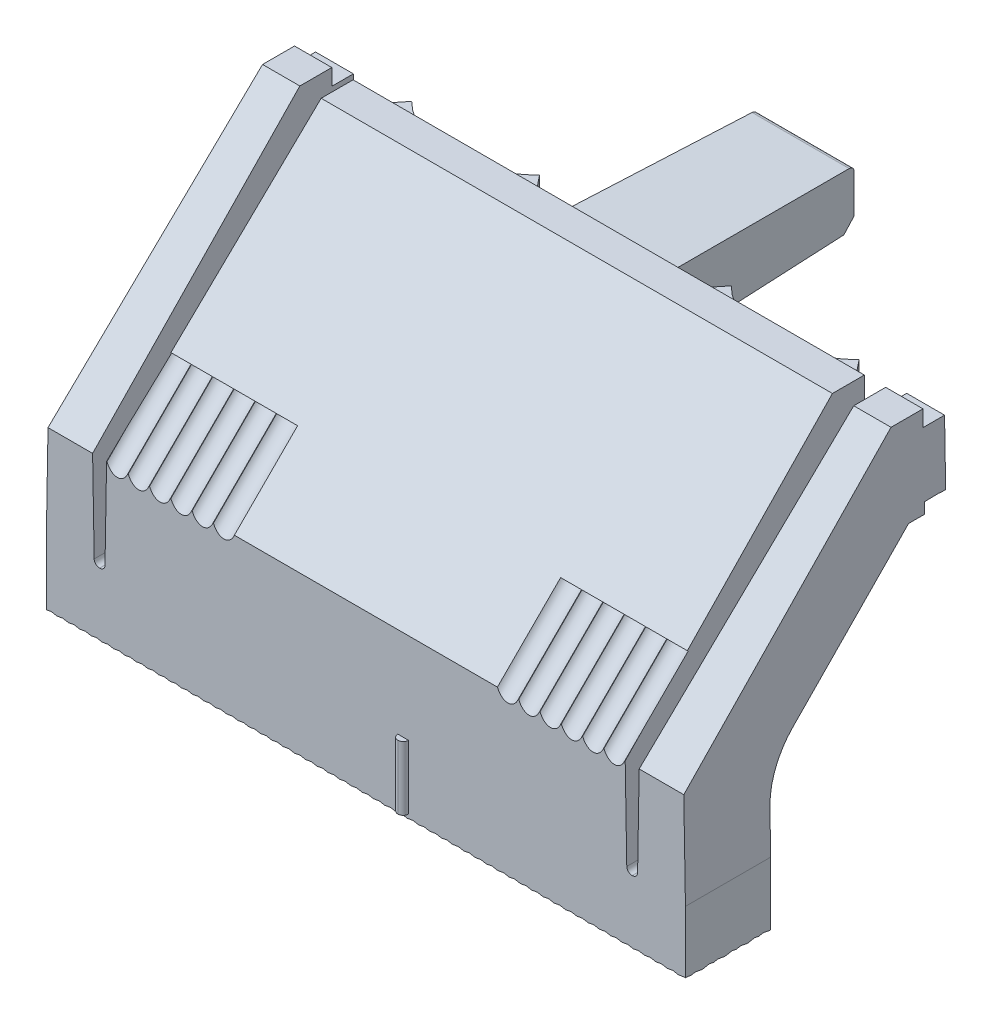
SolidWorks part; units mm, degrees
ref_plane "Plan de face" through (0, 0, 0) normal (0, 0, 1) x (1, 0, 0)
ref_plane "Plan de dessus" through (0, 0, 0) normal (0, 1, 0) x (1, 0, 0)
ref_plane "Plan de droite" through (0, 0, 0) normal (1, 0, 0) x (0, 0, -1)
sketch "Esquisse1" plane through (0, 0, 0) normal (1, 0, 0) x (0, 0, -1)
  line L0 (-4, -15) -> (4, -15)
  line L1 (-4, -15) -> (-4, 0)
  line L2 (-4, 0) -> (15.799, 19.799)
  line L3 (15.799, 19.799) -> (18.799, 19.799)
  line L4 (18.799, 19.799) -> (18.799, 4.508) construction
  line L5 (18.799, 19.799) -> (18.799, 18.299)
  line L6 (4, -15) -> (4, 11.299) construction
  line L7 (17.299, 11.299) -> (2.5901, -3.4099) construction
  line L8 (18.799, 11.299) -> (17.299, 11.299)
  line L9 (17.299, 11.299) -> (4, -1.8505)
  line L10 (4, -1.8505) -> (4, -15)
  line L11 (17.299, 15.299) -> (39.1771, 15.299) construction
  line L12 (18.799, 18.299) -> (37.299, 18.299)
  line L13 (18.799, 12.299) -> (37.299, 12.299)
  line L14 (37.299, 18.299) -> (37.299, 12.299)
  line L15 (18.799, 12.299) -> (18.799, 11.299)
  dimension "D1" = 8
  dimension "D2" = 15
  dimension "D3" = 4
  dimension "D4" = 15
  dimension "D5" = 28
  dimension "D6" = 45
  dimension "D7" = 3
  dimension "D8" = 8.5
  dimension "D9" = 18.7022
  dimension "D10" = 4.5
  dimension "D11" = 1.5
  dimension "D12" = 18.5
  dimension "D13" = 1.5
  dimension "D14" = 3
  dimension "D15" = 1
extrude "Extrusion1" add sketch "Esquisse1" along normal mid plane 60
sketch "Esquisse2" plane through (0, 18.299, 0) normal (0, 1, 0) x (-1, 0, 0)
  line L0 (0, 0) -> (0, -49.2838) construction
  line L1 (-5, -37.299) -> (5, -37.299)
  line L2 (-30, -37.299) -> (30, -37.299) construction
  line L3 (5, -37.299) -> (5, -18.799)
  line L4 (-30, -18.799) -> (30, -18.799) construction
  line L5 (5, -18.799) -> (7, -18.799)
  line L6 (7, -18.799) -> (9, -21.299)
  line L7 (9, -21.299) -> (21, -21.299)
  line L8 (21, -21.299) -> (23, -18.799)
  line L9 (23, -18.799) -> (25, -18.799)
  line L10 (25, -18.799) -> (25, -20.799)
  line L11 (25, -20.799) -> (32.5439, -20.799)
  line L13 (32.5439, -20.799) -> (32.5439, -41.148)
  line L14 (32.5439, -41.148) -> (-32.5439, -41.148)
  line L15 (-5, -18.799) -> (-7, -18.799)
  line L16 (-7, -18.799) -> (-9, -21.299)
  line L17 (-9, -21.299) -> (-21, -21.299)
  line L18 (-21, -21.299) -> (-23, -18.799)
  line L19 (-23, -18.799) -> (-25, -18.799)
  line L20 (-25, -18.799) -> (-25, -20.799)
  line L21 (-25, -20.799) -> (-32.5439, -20.799)
  line L22 (-32.5439, -20.799) -> (-32.5439, -41.148)
  line L23 (-5, -37.299) -> (-5, -18.799)
  point P3 (0, -41.148)
  point P29 (0, -37.299)
  dimension "D1" = 5
  dimension "D2" = 2
  dimension "D3" = 4
  dimension "D4" = 2.5
  dimension "D5" = 12
  dimension "D6" = 14
  dimension "D7" = 2
  dimension "D8" = 2
  dimension "D9" = 20.349
  dimension "D10" = 32.5439
extrude "Enlèv. mat.-Extru.1" cut sketch "Esquisse2" against normal through all
sketch "Esquisse3" plane through (0, 18.299, 0) normal (0, 1, 0) x (-1, 0, 0)
  line L0 (0, 0) -> (0, -43.032) construction
  line L1 (9, -21.299) -> (9, -24.2102)
  line L2 (9, -24.2102) -> (21, -24.2102)
  line L3 (21, -24.2102) -> (21, -21.299)
  line L4 (-21, -24.2102) -> (-21, -21.299)
  line L5 (-9, -24.2102) -> (-21, -24.2102)
  line L6 (-9, -21.299) -> (-9, -24.2102)
  arc A0 (9, -21.299) -> (21, -21.299) centre (15, -27.3198) cw
  arc A1 (-9, -21.299) -> (-21, -21.299) centre (-15, -27.3198) ccw
  dimension "D1" = 8.5
  dimension "D2" = 2.9113
extrude "Enlèv. mat.-Extru.2" cut sketch "Esquisse3" against normal through all
draft "Dépouille1" type of draft neutral plane draft angle 1.4 faces to draft 2 parameters "D1"=1.4
draft "Dépouille2" type of draft neutral plane draft angle 1.4 faces to draft 2 parameters "D1"=1.4
chamfer "Chanfrein1" distance 1 angle 45 1 edges at (0, 12.7511, -37.299)
sketch "Esquisse4" plane through (0, 11.8325, 0.2892) normal (0, -0.9997, -0.0244) x (1, 0, 0)
  line L0 (0, 0) -> (0, -42.5855) construction
  line L1 (4.5479, -37.6244) -> (-4.5479, -37.6244) construction
  line L2 (2.5, -31.6244) -> (-2.5, -31.6244)
  line L3 (2.5, -31.6244) -> (2.5, -34.6244)
  line L4 (2.5, -34.6244) -> (-2.5, -34.6244)
  line L5 (-2.5, -31.6244) -> (-2.5, -34.6244)
  dimension "D1" = 3
  dimension "D2" = 3
  dimension "D3" = 5
  dimension "D4" = 5
extrude "Enlèv. mat.-Extru.3" cut sketch "Esquisse4" against normal blind 3
fillet "Congé1" radius 0.5 1 edges at (0, 17.8469, -37.299)
sketch "Esquisse5" plane through (0, 0, 4) normal (0, 0, 1) x (1, 0, 0)
  line L0 (0, 23.5106) -> (0, -19.7744) construction
  line L1 (-29.5, 19.799) -> (-26, 19.799)
  line L2 (30, 19.799) -> (-30, 19.799) construction
  line L3 (-30, -9) -> (-29.5, 19.799)
  line L6 (-30, 0) -> (-30, -15) construction
  line L7 (30, -15) -> (-30, -15) construction
  line L8 (-30, 19.799) -> (-30, 0) construction
  line L9 (-26, 19.799) -> (-25.5, -9)
  line L10 (-24.5, -9) -> (-24, 19.799)
  line L11 (-25.5, -9) -> (-24.5, -9)
  line L12 (-30, -9) -> (-30, 28.654)
  line L13 (-30, 28.654) -> (-24, 28.654)
  line L14 (-24, 28.654) -> (-24, 19.799)
  line L15 (25.5, -9) -> (24.5, -9)
  line L16 (24, 28.654) -> (24, 19.799)
  line L17 (24.5, -9) -> (24, 19.799)
  line L18 (26, 19.799) -> (25.5, -9)
  line L19 (29.5, 19.799) -> (26, 19.799)
  line L20 (30, 28.654) -> (24, 28.654)
  line L21 (30, -9) -> (29.5, 19.799)
  line L22 (30, -9) -> (30, 28.654)
  dimension "D1" = 6
  dimension "D2" = 0.5
  dimension "D3" = 6
  dimension "D4" = 1
  dimension "D5" = 6
  dimension "D6" = 3.5
  dimension "D7" = 2
  dimension "D8" = 4.5
  dimension "D9" = 8.855
extrude "Enlèv. mat.-Extru.4" cut sketch "Esquisse5" against normal through all
fillet "Congé2" radius 0.5 4 edges at (25.5, -9, 0) (24.5, -9, 0) (-24.5, -9, 0) (-25.5, -9, 0)
sketch "Esquisse8" plane through (0, -2.9356, -2.9026) normal (0, -0.7111, -0.7031) x (1, 0, 0)
  line L0 (0, 15.8392) -> (0, -27.2885) construction
  line L1 (24, -27.2885) -> (-24, -27.2885) construction
  line L2 (24.3759, -1.5433) -> (-24.3759, -1.5433) construction
  line L3 (2, -23.0469) -> (-2, -23.0469)
  line L4 (2, -23.0469) -> (2, 9.9625)
  line L5 (2, 9.9625) -> (-2, 9.9625)
  line L6 (-2, -23.0469) -> (-2, 9.9625)
  dimension "D1" = 4
  dimension "D2" = 33.0094
  dimension "D3" = 2
  dimension "D4" = 11.5058
extrude "Extrusion3" add sketch "Esquisse8" along normal blind 7
sketch "Esquisse9" plane through (-2, 0, 0) normal (-1, 0, 0) x (0, 0, 1)
  line L0 (-18.799, 12.299) -> (-18.799, 2.9381)
  line L1 (-4, -11.6945) -> (-24.2127, 8.291) construction
  line L2 (-18.799, 12.299) -> (-20.2156, 12.3336)
  line L3 (-20.2156, 12.3336) -> (-26.1871, 6.2942)
  line L4 (-14.2087, -9) -> (0, -9) construction
  line L5 (4, -15) -> (-4, -15) construction
  line L6 (-4, -9) -> (-6.7252, -9)
  line L7 (-6.7252, -9) -> (-18.799, 2.9381)
  line L8 (-4, -9) -> (-4, -12.4993)
  line L9 (-4, -15) -> (-4, -9) construction
  line L10 (-4, -12.4993) -> (-6.7252, -12.8306)
  line L11 (-6.7252, -12.8306) -> (-26.1871, 6.2942)
  dimension "D1" = 6
  dimension "D2" = 2.7252
  dimension "D3" = 16.9793
  dimension "D4" = 2.7452
  dimension "D5" = 27.286
  dimension "D6" = 8.4932
extrude "Enlèv. mat.-Extru.5" cut sketch "Esquisse9" against normal through all
ref_plane "Plan2" through (0, -9.5, 9.5) normal (0, -0.7071, 0.7071) x (1, 0, 0)
sketch "Esquisse12" plane through (0, -9.5, 9.5) normal (0, -0.7071, 0.7071) x (1, 0, 0)
  line L0 (-24.3295, 2.8608) -> (-24.3295, 7.2103)
  line L1 (-12.3295, 2.8608) -> (-12.3295, 7.2103)
  line L2 (-12.3295, 7.2103) -> (-24.3295, 7.2103)
  line L3 (0, -1.5673) -> (0, 17.1731) construction
  line L4 (12.3295, 2.8608) -> (12.3295, 7.2103)
  line L5 (12.3295, 7.2103) -> (24.3295, 7.2103)
  line L6 (24.3295, 2.8608) -> (24.3295, 7.2103)
  arc A0 (-24.3295, 2.8608) -> (-22.3295, 2.8608) centre (-23.3295, 3.4009) ccw
  arc A1 (-22.3295, 2.8608) -> (-20.3295, 2.8608) centre (-21.3295, 3.4009) ccw
  arc A2 (-20.3295, 2.8608) -> (-18.3295, 2.8608) centre (-19.3295, 3.4009) ccw
  arc A3 (-18.3295, 2.8608) -> (-16.3295, 2.8608) centre (-17.3295, 3.4009) ccw
  arc A4 (-16.3295, 2.8608) -> (-14.3295, 2.8608) centre (-15.3295, 3.4009) ccw
  arc A5 (-14.3295, 2.8608) -> (-12.3295, 2.8608) centre (-13.3295, 3.4009) ccw
  arc A6 (14.3295, 2.8608) -> (12.3295, 2.8608) centre (13.3295, 3.4009) cw
  arc A7 (16.3295, 2.8608) -> (14.3295, 2.8608) centre (15.3295, 3.4009) cw
  arc A8 (18.3295, 2.8608) -> (16.3295, 2.8608) centre (17.3295, 3.4009) cw
  arc A9 (20.3295, 2.8608) -> (18.3295, 2.8608) centre (19.3295, 3.4009) cw
  arc A10 (22.3295, 2.8608) -> (20.3295, 2.8608) centre (21.3295, 3.4009) cw
  arc A11 (24.3295, 2.8608) -> (22.3295, 2.8608) centre (23.3295, 3.4009) cw
  dimension "D2" = 1.1366
  dimension "D5" = 5.5143
  dimension "D1" = 2
  dimension "D3" = 4.3496
  dimension "D4" = 12
extrude "Enlèv. mat.-Extru.6" cut sketch "Esquisse12" against normal blind 19
sketch "Esquisse13" plane through (2, 0, 0) normal (1, 0, 0) x (0, 0, -1)
  line L0 (-4, -9.7606) -> (-4.1817, -9.9402)
  line L1 (-4.1817, -9.9402) -> (-4, -10.1239)
  line L2 (-4, -10.1239) -> (-4, -9.7606)
extrude "Enlèv. mat.-Extru.7" cut sketch "Esquisse13" against normal through all
sketch "Esquisse14" plane through (0, 0, 4) normal (0, 0, 1) x (1, 0, 0)
  line L0 (30, -9) -> (30, -15) construction
  line L1 (3, -8.5) -> (4, -8.5)
  line L2 (3, -8.5) -> (3, -14.5)
  line L3 (3, -14.5) -> (4, -14.5)
  line L4 (4, -8.5) -> (4, -14.5)
  line L5 (30, -15) -> (-30, -15) construction
  point P4 (30, -12)
  dimension "D1" = 1
  dimension "D2" = 26
  dimension "D3" = 0.5
  dimension "D4" = 6
extrude "Extrusion4" add sketch "Esquisse14" along normal blind 0.5
fillet "Congé3" radius 0.5 2 edges at (3, -11.5, 4.5) (4, -11.5, 4.5)
sketch "Esquisse15" plane through (0, 0, -4) normal (0, 0, -1) x (-1, 0, 0)
  line L0 (0, 0) -> (0, -27.609) construction
  line L1 (-30, -15) -> (30, -15) construction
  line L2 (-29, -9) -> (-28, -9)
  line L3 (-29, -9) -> (-29, 4.4636)
  line L4 (-29, 4.4636) -> (-28, 4.4636)
  line L5 (-28, -9) -> (-28, 4.4636)
  line L6 (-30, -15) -> (-30, -9) construction
  line L7 (29, 4.4636) -> (28, 4.4636)
  line L8 (28, -9) -> (28, 4.4636)
  line L9 (29, -9) -> (29, 4.4636)
  line L10 (29, -9) -> (28, -9)
  dimension "D1" = 6
  dimension "D2" = 1
  dimension "D3" = 1
extrude "Extrusion5" add sketch "Esquisse15" along normal blind 1
fillet "Congé4" radius 0.5 4 edges at (-29, -4.9309, -5) (-28, -4.9309, -5) (28, -4.9309, -5) (29, -4.9309, -5)
fillet "Congé5" radius 7.5 1 edges at (-13.1879, -1.8505, -4)
fillet "Congé7" radius 7.5 1 edges at (-26.8121, -1.8505, -4)
fillet "Congé8" radius 7.5 2 edges at (26.8121, -1.8505, -4) (13.1879, -1.8505, -4)
ref_plane "Plan4" through (-17, 0, 17) normal (0.7071, 0, -0.7071) x (-0.7071, 0, -0.7071)
sketch "Esquisse16" plane through (-17, 0, 17) normal (0.7071, 0, -0.7071) x (-0.7071, 0, -0.7071)
  line L0 (20.7761, -15) -> (25.8072, -15) construction
  line L1 (-18.3848, -15) -> (24.0416, -15) construction
  line L2 (24.0416, -14.8) -> (23.2916, -15)
  line L3 (24.0416, -15) -> (24.0416, -9) construction
  line L4 (23.2916, -15) -> (22.5416, -14.8)
  line L5 (21.7916, -15) -> (21.0416, -14.8)
  line L6 (22.5416, -14.8) -> (21.7916, -15)
  line L7 (20.2916, -15) -> (19.5416, -14.8)
  line L8 (21.0416, -14.8) -> (20.2916, -15)
  line L9 (18.7916, -15) -> (18.0416, -14.8)
  line L10 (19.5416, -14.8) -> (18.7916, -15)
  line L11 (17.2916, -15) -> (16.5416, -14.8)
  line L12 (18.0416, -14.8) -> (17.2916, -15)
  line L13 (15.7916, -15) -> (15.0416, -14.8)
  line L14 (16.5416, -14.8) -> (15.7916, -15)
  line L15 (14.2916, -15) -> (13.5416, -14.8)
  line L16 (15.0416, -14.8) -> (14.2916, -15)
  line L17 (12.7916, -15) -> (12.0416, -14.8)
  line L18 (13.5416, -14.8) -> (12.7916, -15)
  line L19 (11.2916, -15) -> (10.5416, -14.8)
  line L20 (12.0416, -14.8) -> (11.2916, -15)
  line L21 (9.7916, -15) -> (9.0416, -14.8)
  line L22 (10.5416, -14.8) -> (9.7916, -15)
  line L23 (8.2916, -15) -> (7.5416, -14.8)
  line L24 (9.0416, -14.8) -> (8.2916, -15)
  line L25 (6.7916, -15) -> (6.0416, -14.8)
  line L26 (7.5416, -14.8) -> (6.7916, -15)
  line L27 (5.2916, -15) -> (4.5416, -14.8)
  line L28 (6.0416, -14.8) -> (5.2916, -15)
  line L29 (3.7916, -15) -> (3.0416, -14.8)
  line L30 (4.5416, -14.8) -> (3.7916, -15)
  line L31 (2.2916, -15) -> (1.5416, -14.8)
  line L32 (3.0416, -14.8) -> (2.2916, -15)
  line L33 (0.7916, -15) -> (0.0416, -14.8)
  line L34 (1.5416, -14.8) -> (0.7916, -15)
  line L35 (-0.7084, -15) -> (-1.4584, -14.8)
  line L36 (0.0416, -14.8) -> (-0.7084, -15)
  line L37 (-2.2084, -15) -> (-2.9584, -14.8)
  line L38 (-1.4584, -14.8) -> (-2.2084, -15)
  line L39 (-3.7084, -15) -> (-4.4584, -14.8)
  line L40 (-2.9584, -14.8) -> (-3.7084, -15)
  line L41 (-5.2084, -15) -> (-5.9584, -14.8)
  line L42 (-4.4584, -14.8) -> (-5.2084, -15)
  line L43 (-6.7084, -15) -> (-7.4584, -14.8)
  line L44 (-5.9584, -14.8) -> (-6.7084, -15)
  line L45 (-8.2084, -15) -> (-8.9584, -14.8)
  line L46 (-7.4584, -14.8) -> (-8.2084, -15)
  line L47 (-9.7084, -15) -> (-10.4584, -14.8)
  line L48 (-8.9584, -14.8) -> (-9.7084, -15)
  line L49 (-11.2084, -15) -> (-11.9584, -14.8)
  line L50 (-10.4584, -14.8) -> (-11.2084, -15)
  line L51 (-12.7084, -15) -> (-13.4584, -14.8)
  line L52 (-11.9584, -14.8) -> (-12.7084, -15)
  line L53 (-14.2084, -15) -> (-14.9584, -14.8)
  line L54 (-13.4584, -14.8) -> (-14.2084, -15)
  line L55 (-15.7084, -15) -> (-16.4584, -14.8)
  line L56 (-14.9584, -14.8) -> (-15.7084, -15)
  line L57 (-17.2084, -15) -> (-17.9584, -14.8)
  line L58 (-16.4584, -14.8) -> (-17.2084, -15)
  line L59 (-18.7084, -15) -> (-19.4584, -14.8)
  line L60 (-17.9584, -14.8) -> (-18.7084, -15)
  line L61 (-20.2084, -15) -> (-20.9584, -14.8)
  line L62 (-19.4584, -14.8) -> (-20.2084, -15)
  line L63 (-21.7084, -15) -> (-22.4584, -14.8)
  line L64 (-20.9584, -14.8) -> (-21.7084, -15)
  line L65 (-23.2084, -15) -> (-23.9584, -14.8)
  line L66 (-22.4584, -14.8) -> (-23.2084, -15)
  line L67 (-23.9584, -14.8) -> (-24.0416, -14.826)
  line L68 (-24.0416, -9) -> (-24.0416, -15) construction
  line L69 (-24.0416, -14.826) -> (-24.0416, -15.182)
  line L70 (24.0416, -14.8) -> (24.0416, -15.8513)
  line L71 (24.0416, -15.8513) -> (-24.0416, -15.182)
  line L87 (-35.2084, -15) -> (-35.9584, -14.8)
  line L88 (-34.4584, -14.8) -> (-35.2084, -15)
  line L89 (-33.7084, -15) -> (-34.4584, -14.8)
  line L90 (-32.9584, -14.8) -> (-33.7084, -15)
  line L91 (-32.2084, -15) -> (-32.9584, -14.8)
  line L92 (-31.4584, -14.8) -> (-32.2084, -15)
  line L93 (-30.7084, -15) -> (-31.4584, -14.8)
  line L94 (-29.9584, -14.8) -> (-30.7084, -15)
  line L95 (-29.2084, -15) -> (-29.9584, -14.8)
  line L96 (-28.4584, -14.8) -> (-29.2084, -15)
  line L97 (-27.7084, -15) -> (-28.4584, -14.8)
  line L98 (-26.9584, -14.8) -> (-27.7084, -15)
  line L99 (-26.2084, -15) -> (-26.9584, -14.8)
  line L100 (-25.4584, -14.8) -> (-26.2084, -15)
  line L101 (-24.7084, -15) -> (-25.4584, -14.8)
  line L102 (-23.9584, -14.8) -> (-24.7084, -15)
  dimension "D1" = 0.4
  dimension "D2" = 0.75
  dimension "D3" = 0.75
  dimension "D4" = 0.4
extrude "Enlèv. mat.-Extru.11" cut sketch "Esquisse16" along normal through all
ref_plane "Plan7" through (17, 0, 17) normal (0.7071, 0, 0.7071) x (0.7071, 0, -0.7071)
sketch "Esquisse17" plane through (17, 0, 17) normal (0.7071, 0, 0.7071) x (0.7071, 0, -0.7071)
  line L0 (16.8652, -15) -> (26.9234, -15) construction
  line L1 (24.2967, -15) -> (25.0467, -14.8)
  line L2 (25.0467, -14.8) -> (25.7967, -15)
  line L3 (22.7967, -15) -> (23.5467, -14.8)
  line L4 (23.5467, -14.8) -> (24.2967, -15)
  line L5 (21.2967, -15) -> (22.0467, -14.8)
  line L6 (22.0467, -14.8) -> (22.7967, -15)
  line L7 (19.7967, -15) -> (20.5467, -14.8)
  line L8 (20.5467, -14.8) -> (21.2967, -15)
  line L9 (18.2967, -15) -> (19.0467, -14.8)
  line L10 (19.0467, -14.8) -> (19.7967, -15)
  line L11 (16.7967, -15) -> (17.5467, -14.8)
  line L12 (17.5467, -14.8) -> (18.2967, -15)
  line L13 (15.2967, -15) -> (16.0467, -14.8)
  line L14 (16.0467, -14.8) -> (16.7967, -15)
  line L15 (13.7967, -15) -> (14.5467, -14.8)
  line L16 (14.5467, -14.8) -> (15.2967, -15)
  line L17 (12.2967, -15) -> (13.0467, -14.8)
  line L18 (13.0467, -14.8) -> (13.7967, -15)
  line L19 (10.7967, -15) -> (11.5467, -14.8)
  line L20 (11.5467, -14.8) -> (12.2967, -15)
  line L21 (9.2967, -15) -> (10.0467, -14.8)
  line L22 (10.0467, -14.8) -> (10.7967, -15)
  line L23 (7.7967, -15) -> (8.5467, -14.8)
  line L24 (8.5467, -14.8) -> (9.2967, -15)
  line L25 (6.2967, -15) -> (7.0467, -14.8)
  line L26 (7.0467, -14.8) -> (7.7967, -15)
  line L27 (4.7967, -15) -> (5.5467, -14.8)
  line L28 (5.5467, -14.8) -> (6.2967, -15)
  line L29 (3.2967, -15) -> (4.0467, -14.8)
  line L30 (4.0467, -14.8) -> (4.7967, -15)
  line L31 (1.7967, -15) -> (2.5467, -14.8)
  line L32 (2.5467, -14.8) -> (3.2967, -15)
  line L33 (0.2967, -15) -> (1.0467, -14.8)
  line L34 (1.0467, -14.8) -> (1.7967, -15)
  line L35 (-1.2033, -15) -> (-0.4533, -14.8)
  line L36 (-0.4533, -14.8) -> (0.2967, -15)
  line L37 (-2.7033, -15) -> (-1.9533, -14.8)
  line L38 (-1.9533, -14.8) -> (-1.2033, -15)
  line L39 (-4.2033, -15) -> (-3.4533, -14.8)
  line L40 (-3.4533, -14.8) -> (-2.7033, -15)
  line L41 (-5.7033, -15) -> (-4.9533, -14.8)
  line L42 (-4.9533, -14.8) -> (-4.2033, -15)
  line L43 (-7.2033, -15) -> (-6.4533, -14.8)
  line L44 (-6.4533, -14.8) -> (-5.7033, -15)
  line L45 (-8.7033, -15) -> (-7.9533, -14.8)
  line L46 (-7.9533, -14.8) -> (-7.2033, -15)
  line L47 (-10.2033, -15) -> (-9.4533, -14.8)
  line L48 (-9.4533, -14.8) -> (-8.7033, -15)
  line L49 (-11.7033, -15) -> (-10.9533, -14.8)
  line L50 (-10.9533, -14.8) -> (-10.2033, -15)
  line L51 (-13.2033, -15) -> (-12.4533, -14.8)
  line L52 (-12.4533, -14.8) -> (-11.7033, -15)
  line L53 (-14.7033, -15) -> (-13.9533, -14.8)
  line L54 (-13.9533, -14.8) -> (-13.2033, -15)
  line L55 (-16.2033, -15) -> (-15.4533, -14.8)
  line L56 (-15.4533, -14.8) -> (-14.7033, -15)
  line L57 (-17.7033, -15) -> (-16.9533, -14.8)
  line L58 (-16.9533, -14.8) -> (-16.2033, -15)
  line L59 (-19.2033, -15) -> (-18.4533, -14.8)
  line L60 (-18.4533, -14.8) -> (-17.7033, -15)
  line L61 (-20.7033, -15) -> (-19.9533, -14.8)
  line L62 (-19.9533, -14.8) -> (-19.2033, -15)
  line L63 (-22.2033, -15) -> (-21.4533, -14.8)
  line L64 (-21.4533, -14.8) -> (-20.7033, -15)
  line L65 (-23.7033, -15) -> (-22.9533, -14.8)
  line L66 (-22.9533, -14.8) -> (-22.2033, -15)
  line L67 (-25.2033, -15) -> (-24.4533, -14.8)
  line L68 (-24.4533, -14.8) -> (-23.7033, -15)
  line L69 (-26.7033, -15) -> (-25.9533, -14.8)
  line L70 (-25.9533, -14.8) -> (-25.2033, -15)
  line L71 (-28.2033, -15) -> (-27.4533, -14.8)
  line L72 (-27.4533, -14.8) -> (-26.7033, -15)
  line L73 (-29.7033, -15) -> (-28.9533, -14.8)
  line L74 (-28.9533, -14.8) -> (-28.2033, -15)
  line L75 (-31.2033, -15) -> (-30.4533, -14.8)
  line L76 (-30.4533, -14.8) -> (-29.7033, -15)
  line L77 (-32.7033, -15) -> (-31.9533, -14.8)
  line L78 (-31.9533, -14.8) -> (-31.2033, -15)
  line L79 (-34.2033, -15) -> (-33.4533, -14.8)
  line L80 (-33.4533, -14.8) -> (-32.7033, -15)
  line L81 (25.7967, -15) -> (25.7967, -15.8979)
  line L82 (25.7967, -15.8979) -> (-34.2033, -15.8979)
  line L83 (-34.2033, -15.8979) -> (-34.2033, -15)
  dimension "D1" = 0.75
  dimension "D2" = 0.75
  dimension "D3" = 0.2
extrude "Enlèv. mat.-Extru.12" cut sketch "Esquisse17" against normal through all
